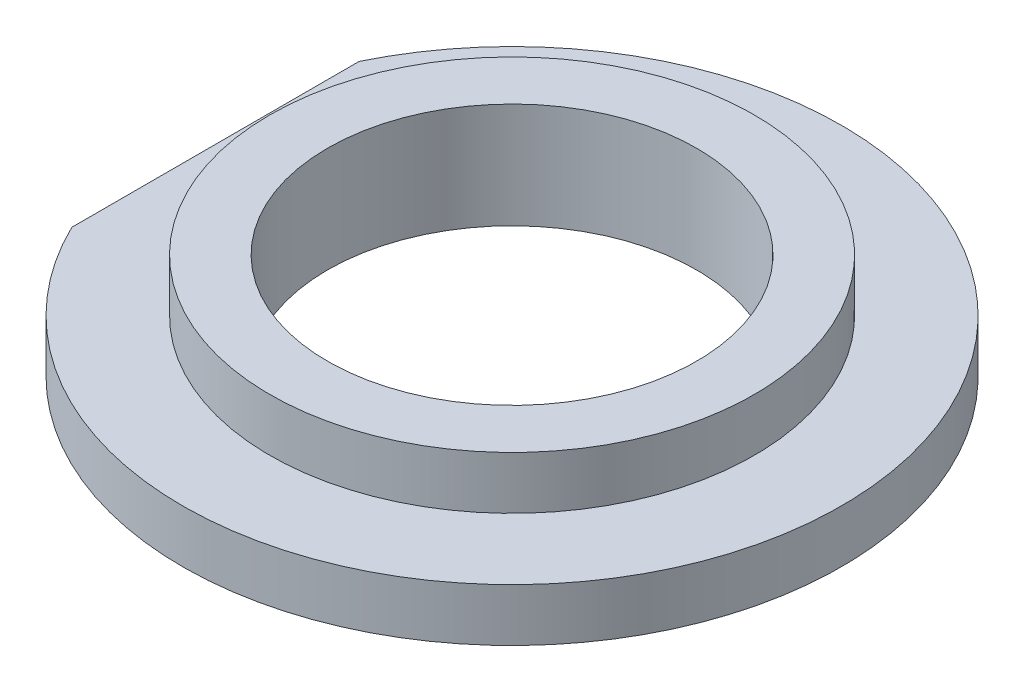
SolidWorks part; units mm, degrees
ref_plane "前视基准面" through (0, 0, 0) normal (0, 0, 1) x (1, 0, 0)
ref_plane "上视基准面" through (0, 0, 0) normal (0, 1, 0) x (1, 0, 0)
ref_plane "右视基准面" through (0, 0, 0) normal (1, 0, 0) x (0, 0, -1)
sketch "草图1" plane through (0, 0, 0) normal (0, 0, 1) x (1, 0, 0)
  line L0 (0, 0) -> (-100, 0)
  line L1 (-100, 0) -> (-100, 16)
  line L2 (-100, 16) -> (-73.5, 16)
  line L3 (-73.5, 16) -> (-73.5, 32)
  line L4 (-73.5, 32) -> (0, 32)
  line L5 (0, 32) -> (0, 0)
  dimension "D1" = 32
  dimension "D2" = 100
  dimension "D3" = 16
  dimension "D4" = 73.5
revolve "旋转1" add sketch "草图1" angle 360 about L5
sketch "草图2" plane through (0, 32, 0) normal (0, 1, 0) x (1, 0, 0)
  circle A0 centre (0, 0) radius 56
extrude "拉伸1" cut sketch "草图2" against normal through all
sketch "草图3" plane through (0, 16, 0) normal (0, 1, 0) x (1, 0, 0)
  line L1 (-125.5212, 86.2002) -> (-90, 86.2002)
  line L2 (-125.5212, 86.2002) -> (-125.5212, -99.6737)
  line L3 (-125.5212, -99.6737) -> (-90, -99.6737)
  line L4 (-90, 86.2002) -> (-90, -99.6737)
  circle A1 centre (0, 0) radius 100 construction
  dimension "D1" = 10
extrude "拉伸2" cut sketch "草图3" against normal through all
